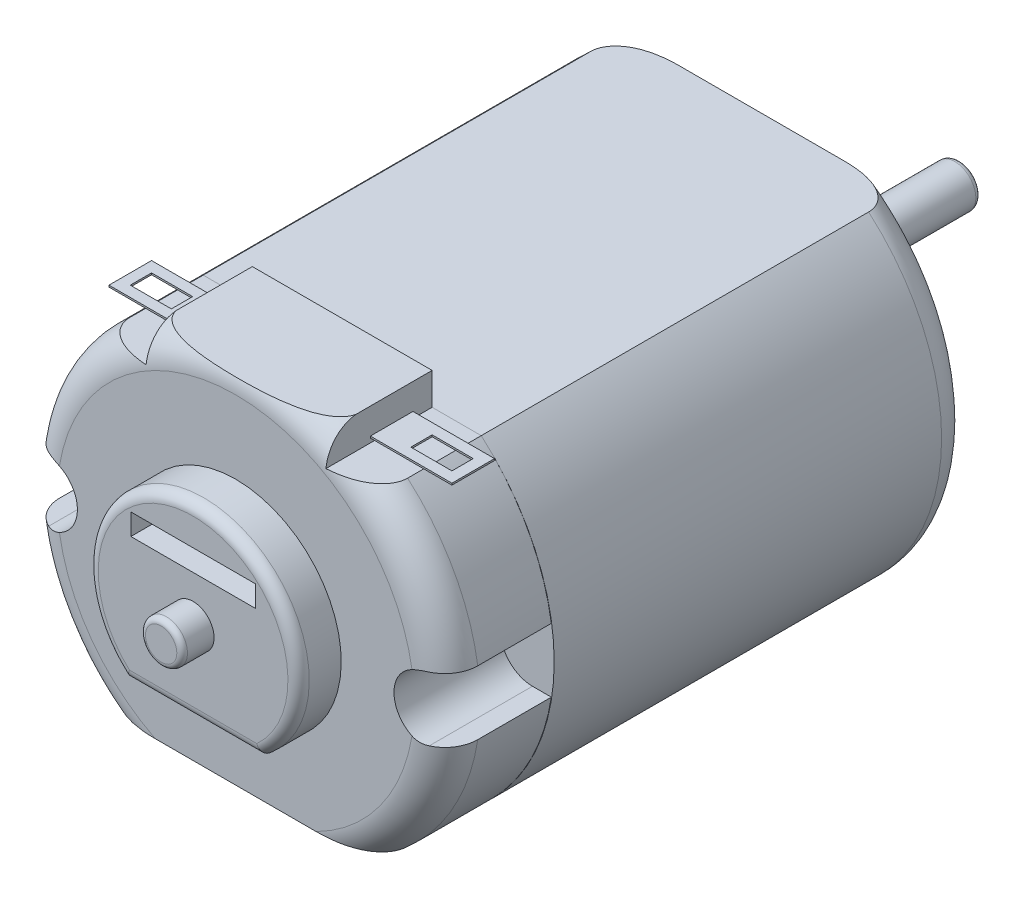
SolidWorks part; units mm, degrees
ref_plane "Front" through (0, 0, 0) normal (0, 0, 1) x (1, 0, 0)
ref_plane "Top" through (0, 0, 0) normal (0, 1, 0) x (1, 0, 0)
ref_plane "Right" through (0, 0, 0) normal (1, 0, 0) x (0, 0, -1)
sketch "Sketch1" plane through (0, 0, 0) normal (0, 0, 1) x (1, 0, 0)
  line L1 (-6.5253, -7.485) -> (6.5253, -7.485)
  line L3 (-6.5253, 7.485) -> (6.5253, 7.485)
  arc A2 (-6.5253, 7.485) -> (-6.5253, -7.485) centre (0, 0) ccw
  arc A3 (6.5253, -7.485) -> (6.5253, 7.485) centre (0, 0) ccw
  dimension "D1" = 13.0506
  dimension "D2" = 13.0506
  dimension "D3" = 9.93
extrude "Extrude1" add sketch "Sketch1" along normal blind 5
sketch "Sketch2" plane through (0, 0, 5) normal (0, 0, 1) x (1, 0, 0)
  line L3 (-3.175, -3.8015) -> (3.175, -3.8015)
  arc A0 (3.175, -3.8015) -> (-3.175, -3.8015) centre (0, 0) ccw
  dimension "D1" = 4.953
  dimension "D2" = 6.35
extrude "Extrude2" add sketch "Sketch2" along normal blind 2
sketch "Sketch4" plane through (0, 0, 5) normal (0, 0, 1) x (1, 0, 0)
  line L1 (-2.921, 3.1613) -> (2.921, 3.1621)
  line L2 (-2.921, 3.1613) -> (-2.921, 2.1621)
  line L3 (-2.921, 2.1621) -> (2.921, 2.1621)
  line L4 (2.921, 3.1621) -> (2.921, 2.1621)
  dimension "D1" = 5.842
  dimension "D2" = 1
  dimension "D3" = 2.1621
  dimension "D4" = 2.921
  dimension "D5" = 2.921
sketch "Sketch5" plane through (0, 0, 7) normal (0, 0, 1) x (1, 0, 0)
  circle A0 centre (0, 0) radius 0.985
  dimension "D1" = 1.97
extrude "Extrude3" add sketch "Sketch5" along normal blind 1.5
fillet "Fillet1" radius 0.25 1 edges at (0.985, 0, 8.5)
fillet "Fillet2" radius 0.5 2 edges at (0, -3.8015, 7) (0, 4.953, 7)
ref_plane "Plane1" through (0, 0, 0) normal (1, 0, 0) x (0, 0, -1)
sketch "Sketch6" plane through (0, 0, 5) normal (0, 0, 1) x (1, 0, 0)
  line L0 (8.93, 1.5) -> (9.8161, 1.5)
  line L1 (8.93, -1.5) -> (9.8161, -1.5)
  arc A0 (8.93, 1.5) -> (8.93, -1.5) centre (8.93, 0) ccw
  arc A1 (6.5253, -7.485) -> (6.5253, 7.485) centre (0, 0) ccw construction
  arc A2 (9.8161, -1.5) -> (9.8161, 1.5) centre (0, 0) ccw
extrude "Cut-Extrude2" cut sketch "Sketch6" against normal through all
mirror "Mirror1" about plane through (0, 0, 0) normal (1, 0, 0) of "Cut-Extrude2"
sketch "Sketch7" plane through (0, 7.485, 0) normal (0, 1, 0) x (-1, 0, 0)
  line L0 (-6.5253, 0) -> (6.5253, 0) construction
  line L1 (4.22, 5) -> (-4.22, 5)
  line L2 (4.22, 5) -> (4.22, 0)
  line L3 (4.22, 0) -> (-4.22, 0)
  line L4 (-4.22, 5) -> (-4.22, 0)
  line L5 (-6.5253, 5) -> (6.5253, 5) construction
  line L6 (0, 5) -> (0, 0) construction
  dimension "D1" = 8.44
  dimension "D2" = 4.22
extrude "Extrude4" add sketch "Sketch7" along normal blind 1.5
ref_plane "Plane2" through (0, 0, 0) normal (-0.1511, 0.9885, 0) x (-0.9885, -0.1511, 0)
sketch "Sketch8" plane through (0, 0, 0) normal (-0.1511, 0.9885, 0) x (-0.9885, -0.1511, 0)
  line L0 (9.93, 5) -> (8.1683, 3.2383) construction
  line L1 (9.4768, 5) -> (5.3198, 5) construction
  line L2 (9.93, 0) -> (9.93, 5) construction
  line L3 (0, 0) -> (0, 9.4796) construction
  line L4 (9.93, 3.4535) -> (12.3357, 3.4535)
  line L5 (8.3835, 5) -> (8.3835, 5.7279)
  line L6 (8.3835, 5.7279) -> (12.3357, 5.7279)
  line L7 (12.3357, 3.4535) -> (12.3357, 5.7279)
  arc A0 (9.93, 3.4535) -> (8.3835, 5) centre (8.3835, 3.4535) ccw
  dimension "D1" = 45
revolve "Cut-Revolve1" cut sketch "Sketch8" angle 360 about L3
sketch "Sketch9" plane through (4.22, 0, 0) normal (1, 0, 0) x (0, 0, -1)
  line L0 (-3.4535, 7.485) -> (0, 7.485) construction
  line L1 (-2.9, 7.765) -> (-0.9, 7.765)
  line L2 (-2.9, 7.765) -> (-2.9, 7.685)
  line L3 (-2.9, 7.685) -> (-0.9, 7.685)
  line L4 (-0.9, 7.765) -> (-0.9, 7.685)
  line L5 (0, 8.985) -> (0, 7.485) construction
  dimension "D1" = 2
  dimension "D2" = 0.08
  dimension "D3" = 0.2
  dimension "D4" = 0.9
extrude "Extrude5" add sketch "Sketch9" along normal blind 3.83
sketch "Sketch10" plane through (0, 7.765, 0) normal (0, 1, 0) x (-1, 0, 0)
  line L0 (-8.05, 0.9) -> (-8.05, 2.9) construction
  line L1 (-8.05, 2.9) -> (-4.22, 2.9) construction
  line L2 (-7.55, 2.4) -> (-5.62, 2.4)
  line L3 (-7.55, 2.4) -> (-7.55, 1.4)
  line L4 (-7.55, 1.4) -> (-5.62, 1.4)
  line L5 (-5.62, 2.4) -> (-5.62, 1.4)
  line L7 (-8.05, 0.9) -> (-4.22, 0.9) construction
  dimension "D1" = 1.93
  dimension "D2" = 0.5
  dimension "D3" = 0.5
  dimension "D4" = 0.5
extrude "Cut-Extrude4" cut sketch "Sketch10" against normal up to next contours L3 L4 L5 L2
sketch "Sketch21" plane through (-4.22, 0, 0) normal (-1, 0, 0) x (0, 0, 1)
  line L0 (0, 8.985) -> (0, 7.485) construction
  line L1 (0.9, 7.765) -> (2.9, 7.765)
  line L2 (0.9, 7.765) -> (0.9, 7.685)
  line L3 (0.9, 7.685) -> (2.9, 7.685)
  line L4 (2.9, 7.765) -> (2.9, 7.685)
  line L5 (3.4535, 7.485) -> (0, 7.485) construction
  dimension "D1" = 0.9
  dimension "D2" = 2
  dimension "D3" = 0.08
  dimension "D4" = 0.2
extrude "Extrude6" add sketch "Sketch21" along normal blind 3.83
sketch "Sketch22" plane through (0, 7.765, 0) normal (0, 1, 0) x (-1, 0, 0)
  line L0 (8.05, 0.9) -> (4.22, 0.9) construction
  line L1 (7.55, 1.4) -> (5.62, 1.4)
  line L2 (7.55, 1.4) -> (7.55, 2.4)
  line L3 (7.55, 2.4) -> (5.62, 2.4)
  line L4 (5.62, 1.4) -> (5.62, 2.4)
  line L5 (8.05, 2.9) -> (4.22, 2.9) construction
  line L6 (8.05, 2.9) -> (8.05, 0.9) construction
  dimension "D1" = 1.93
  dimension "D2" = 0.5
  dimension "D3" = 0.5
  dimension "D4" = 0.5
extrude "Cut-Extrude5" cut sketch "Sketch22" against normal blind 0.09
sketch "Sketch23" plane through (0, 0, 0) normal (0, 0, -1) x (-1, 0, 0)
  line L0 (-6.5253, 7.485) -> (6.5253, 7.485)
  line L1 (-6.5253, -7.485) -> (6.5253, -7.485)
  arc A0 (6.5253, 7.485) -> (6.5253, -7.485) centre (-0.0106, 0) cw
  arc A1 (-6.5253, 7.485) -> (-6.5253, -7.485) centre (-0.0593, 0) ccw
extrude "Extrude7" add sketch "Sketch23" along normal blind 19.685 separate body
fillet "Fillet6" radius 1.5 2 edges at (9.9504, 0, -19.685) (-9.9264, 0, -19.685)
sketch "Sketch26" plane through (0, 0, -19.685) normal (0, 0, -1) x (-1, 0, 0)
  circle A0 centre (0, 0) radius 3.048
  dimension "D1" = 6.096
extrude "Extrude9" add sketch "Sketch26" along normal blind 1.6002
sketch "Sketch27" plane through (0, 0, -21.2852) normal (0, 0, -1) x (-1, 0, 0)
  circle A0 centre (0, 0) radius 2.54
  dimension "D1" = 5.08
extrude "Cut-Extrude6" cut sketch "Sketch27" against normal blind 0.5334
chamfer "Chamfer1" distance 0.4 angle 20 1 edges at (-3.048, 0, -21.2852)
sketch "Sketch29" plane through (0, 0, -20.7518) normal (0, 0, -1) x (-1, 0, 0)
  circle A0 centre (0, 0) radius 0.985
  dimension "D1" = 1.97
extrude "Extrude10" add sketch "Sketch29" along normal blind 8.255
fillet "Fillet7" radius 0.25 1 edges at (-0.985, 0, -29.0068)
sketch "Sketch30" plane through (0, 0, -19.685) normal (0, 0, -1) x (-1, 0, 0)
  line L0 (-3.8522, -7.485) -> (3.8826, -7.485) construction
  circle A0 centre (0, -5.199) radius 0.7303
  dimension "D1" = 1.4605
  dimension "D2" = 2.286
extrude "Cut-Extrude7" cut sketch "Sketch30" against normal blind 8.255
extrude "Cut-Extrude9" cut sketch "Sketch4" against normal blind 5 and the other way blind 2
